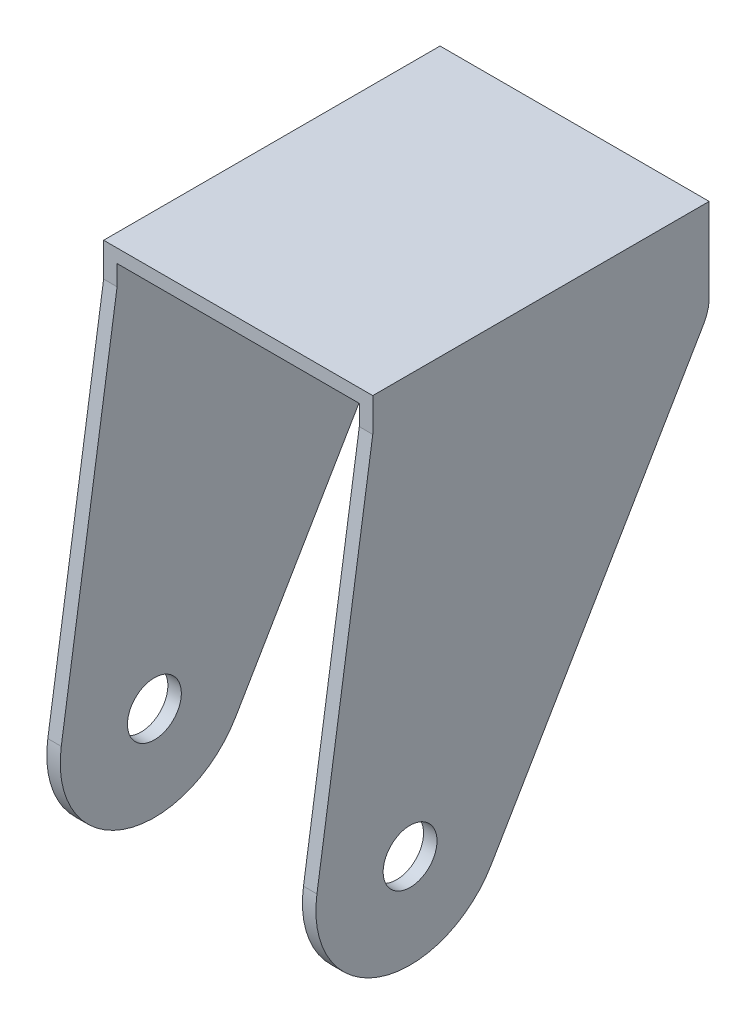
SolidWorks part; units mm, degrees
ref_plane "Front Plane" through (0, 0, 0) normal (0, 0, 1) x (1, 0, 0)
ref_plane "Top Plane" through (0, 0, 0) normal (0, 1, 0) x (1, 0, 0)
ref_plane "Right Plane" through (0, 0, 0) normal (1, 0, 0) x (0, 0, -1)
sketch "Sketch1" plane through (0, 0, 0) normal (1, 0, 0) x (0, 0, -1)
  line L0 (-13.8433, 2.0885) -> (-5.5457, 57.0885)
  line L1 (-5.5457, 57.0885) -> (-5.5457, 62.0885)
  line L2 (-5.5457, 62.0885) -> (44.4543, 62.0885)
  line L3 (44.4543, 62.0885) -> (44.4543, 49.7191)
  line L4 (43.629, 46.6822) -> (12.0743, -7.086)
  arc A0 (-13.8433, 2.0885) -> (12.0743, -7.086) centre (0, 0) ccw
  arc A1 (44.4543, 49.7191) -> (43.629, 46.6822) centre (38.4543, 49.7191) cw
  point P1 (10.5004, 61.9914)
  point P11 (44.4543, 48.0885)
  point P12 (13.4258, 62.2862)
  point P13 (-3.7015, 59.676)
  point P14 (19.2372, 65.499)
  point P15 (-3.1154, 59.7901)
  dimension "D1" = 28
  dimension "D6" = 6
  dimension "D2" = 60
  dimension "D3" = 5
  dimension "D4" = 50
  dimension "D5" = 14
extrude "Boss-Extrude1" add sketch "Sketch1" against normal blind 2
ref_plane "Plane1" through (-20, 0, 0) normal (1, 0, 0) x (0, 0, -1)
mirror "Mirror1" about plane through (-20, 0, 0) normal (1, 0, 0)
sketch "Sketch2" plane through (0, 62.0885, 0) normal (0, 1, 0) x (1, 0, 0)
  line L1 (-40, 44.4543) -> (0, 44.4543)
  line L2 (-40, 44.4543) -> (-40, -5.5457)
  line L3 (-40, -5.5457) -> (0, -5.5457)
  line L4 (0, 44.4543) -> (0, -5.5457)
extrude "Boss-Extrude2" add sketch "Sketch2" against normal blind 2
sketch "Sketch3" plane through (0, 62.0885, 0) normal (0, 1, 0) x (1, 0, 0)
  line L0 (0, 19.4543) -> (-40, 19.4543) construction
  line L1 (0, 44.4543) -> (0, -5.5457) construction
  line L2 (-40, 44.4543) -> (-40, -5.5457) construction
  line L3 (-40, 19.4543) -> (-20, -5.5457) construction
  line L4 (-40, -5.5457) -> (0, -5.5457) construction
  line L5 (-20, -5.5457) -> (-20, 44.4543) construction
  line L6 (-40, 44.4543) -> (0, 44.4543) construction
  line L10 (-18, 13.5942) -> (-9.6438, 29.4543)
  line L11 (-22, 13.5942) -> (-30.3562, 29.4543)
  arc A0 (-22, 13.5942) -> (-18, 13.5942) centre (-20, 23.3922) ccw
  arc A1 (-30.3562, 29.4543) -> (-9.6438, 29.4543) centre (-20, 23.3922) ccw
  arc A2 (-22.4, 11.6346) -> (-17.6, 11.6346) centre (-20, 23.3922) ccw construction
  point P9 (0, 0)
  point P13 (0, 0)
  point P14 (-21.1934, 25.7428)
  point P23 (0, 0)
  dimension "D3" = 20
  dimension "D1" = 20.7123
  dimension "D2" = 2
  dimension "D4" = 15
  dimension "D5" = 2
extrude "Boss-Extrude3" add sketch "Sketch3" against normal blind 4
sketch "Sketch4" plane through (0, 60.0885, 0) normal (0, -1, 0) x (1, 0, 0)
  line L3 (-38, 5.5457) -> (-38, -44.4543)
  line L5 (-38, -44.4543) -> (-2, -44.4543)
  line L8 (-38, -44.4543) -> (-2, -44.4543)
  line L10 (-38, 5.5457) -> (-38, -44.4543)
  line L15 (-2, -44.4543) -> (-2, 5.5457)
  line L16 (-2, -44.4543) -> (-2, 5.5457)
  line L17 (-2, 5.5457) -> (-38, 5.5457)
  line L18 (-2, 5.5457) -> (-38, 5.5457)
  dimension "D1" = 0
sketch "Sketch5" plane through (0, 0, 0) normal (1, 0, 0) x (0, 0, -1)
  circle A0 centre (0, 0) radius 4
  dimension "D1" = 8
extrude "Cut-Extrude2" cut sketch "Sketch5" along a picked direction on the side against the normal blind 44 from surface at 0
sketch "Sketch6" plane through (0, 0, 0) normal (1, 0, 0) x (0, 0, -1)
  circle A2 centre (0, 0) radius 2.5
  dimension "D1" = 5
